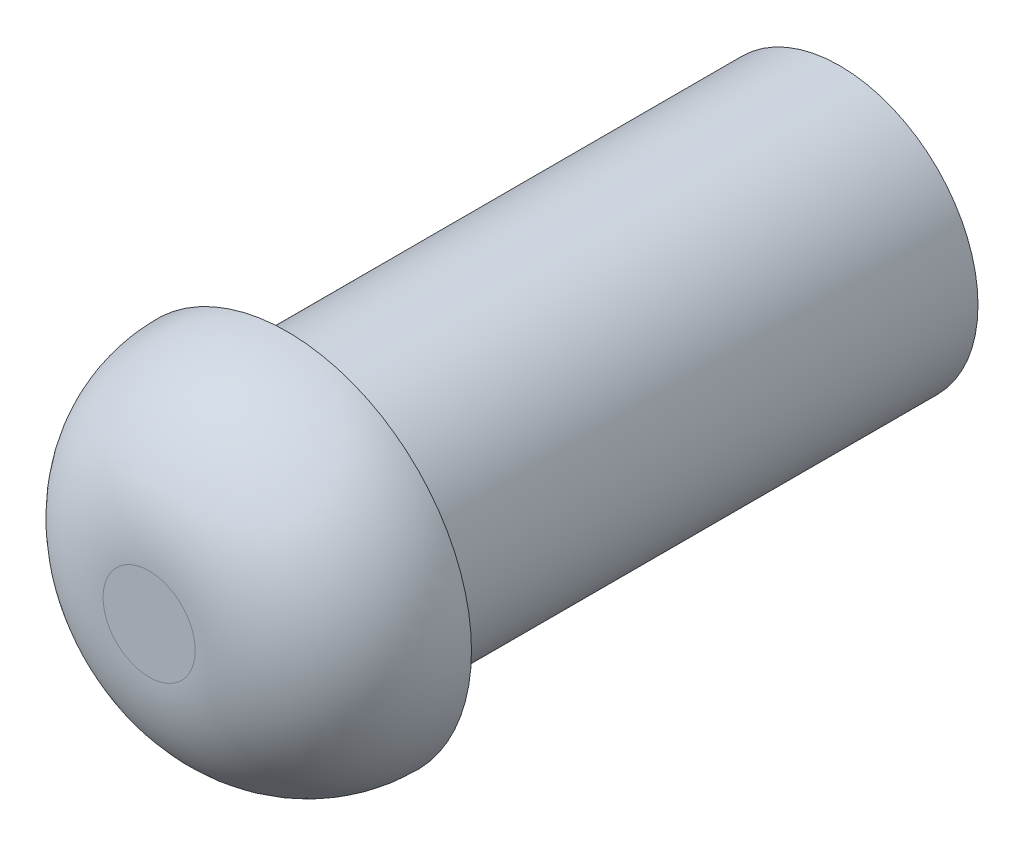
SolidWorks part; units mm, degrees
ref_plane "Спереди" through (0, 0, 0) normal (0, 0, 1) x (1, 0, 0)
ref_plane "Сверху" through (0, 0, 0) normal (0, 1, 0) x (1, 0, 0)
ref_plane "Справа" through (0, 0, 0) normal (1, 0, 0) x (0, 0, -1)
sketch "Эскиз3" plane through (0, 0, 0) normal (0, 0, 1) x (1, 0, 0)
  circle A0 centre (0, 0) radius 4
  dimension "D1" = 8
extrude "Бобышка-Вытянуть1" add sketch "Эскиз3" along normal blind 3
sketch "Эскиз4" plane through (0, 0, 0) normal (0, 0, -1) x (-1, 0, 0)
  circle A0 centre (0, 0) radius 3
  dimension "D1" = 6
extrude "Бобышка-Вытянуть2" add sketch "Эскиз4" along normal blind 12
fillet "Скругление1" radius 3 1 edges at (4, 0, 3)
